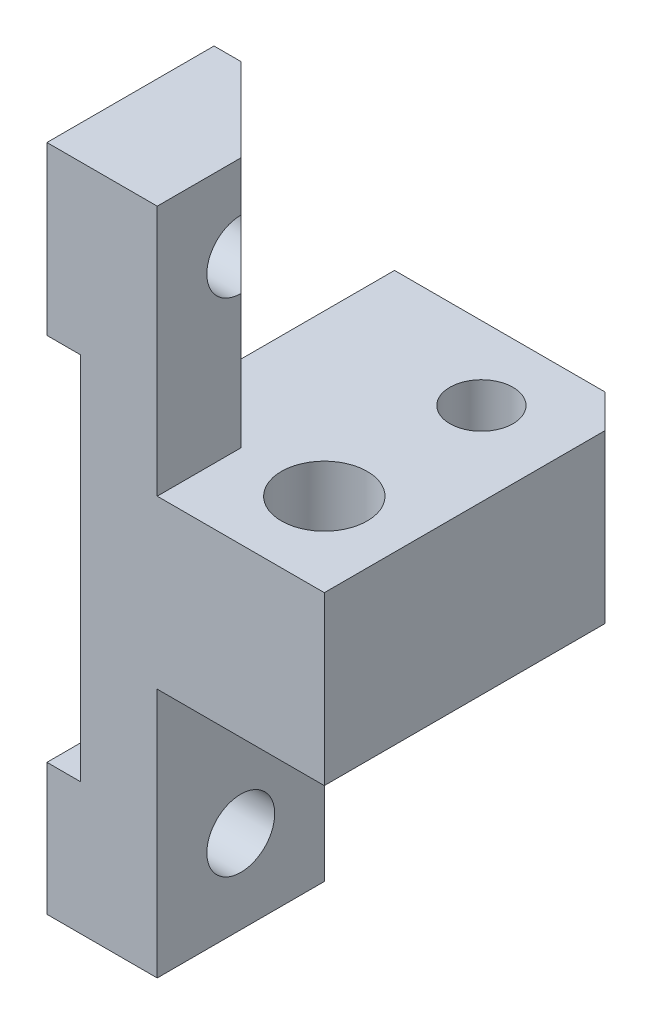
SolidWorks part; units mm, degrees
ref_plane "Front" through (0, 0, 0) normal (0, 0, 1) x (1, 0, 0)
ref_plane "Top" through (0, 0, 0) normal (0, 1, 0) x (1, 0, 0)
ref_plane "Right" through (0, 0, 0) normal (1, 0, 0) x (0, 0, -1)
sketch "Sketch1" plane through (0, 0, 0) normal (0, 0, 1) x (1, 0, 0)
  line L1 (0, 12.7) -> (4.191, 12.7)
  line L2 (0, 12.7) -> (0, -12.7)
  line L3 (0, -12.7) -> (4.191, -12.7)
  line L4 (4.191, 12.7) -> (4.191, -12.7)
  point P5 (0, 0)
  point P6 (0, 0)
  dimension "D1" = 4.191
  dimension "D2" = 25.4
extrude "Extrude1" add sketch "Sketch1" along normal blind 6.35
sketch "Sketch2" plane through (4.191, 0, 0) normal (1, 0, 0) x (0, 0, -1)
  line L0 (-6.35, -12.7) -> (-6.35, 12.7) construction
  line L1 (0, -3.1942) -> (-6.35, -3.1942)
  line L2 (0, -3.1942) -> (0, 3.1558)
  line L3 (0, 3.1558) -> (-6.35, 3.1558)
  line L4 (-6.35, -3.1942) -> (-6.35, 3.1558)
  line L8 (0, -12.7) -> (0, 12.7) construction
  dimension "D1" = 6.35
  dimension "D2" = 3.1558
extrude "Extrude2" add sketch "Sketch2" along normal blind 6.35
hole_wizard "#30 (0.128500) Diameter Hole1" positions "Sketch4" profile "Sketch3" hole size "#30" standard "Ansi Inch"
sketch "Sketch4" plane through (0, 3.1558, 0) normal (0, 1, 0) x (-1, 0, 0)
  line L1 (-10.541, 0) -> (-4.191, 0) construction
  line L2 (-4.191, 0) -> (-4.191, 6.35) construction
  point P0 (-7.366, 3.175)
  dimension "D1" = 3.175
  dimension "D2" = 3.175
sketch "Sketch3" plane through (7.366, 3.1558, 3.175) normal (1, 0, 0) x (0, 0, 1)
  line L0 (0, 0) -> (0, 15.8559)
  line L1 (0, 15.8559) -> (1.6319, 15.8559)
  line L2 (1.6319, 15.8559) -> (1.6319, 0)
  line L5 (1.6319, 0) -> (0, 0)
  line L11 (0, -6.35) -> (0, 107.95) construction
  dimension "Thru Hole Dia." = 3.2639
  dimension "Thru Hole Depth" = 15.8559
sketch "Sketch7" plane through (0, 0, 0) normal (0, 0, -1) x (-1, 0, 0)
  line L0 (-10.541, 3.1558) -> (-4.191, 3.1558) construction
  line L1 (-10.541, 3.1558) -> (0, 3.1558)
  line L2 (-10.541, 3.1558) -> (-10.541, -3.1942)
  line L3 (-10.541, -3.1942) -> (0, -3.1942)
  line L4 (0, 3.1558) -> (0, -3.1942)
  line L5 (0, 12.7) -> (0, -12.7) construction
  line L6 (-10.541, -3.1942) -> (-4.191, -3.1942) construction
  line L7 (-10.541, -3.1942) -> (-10.541, 3.1558) construction
extrude "Extrude3" add sketch "Sketch7" along normal blind 5.588
hole_wizard "3/32 (0.093750) Diameter Hole1" positions "Sketch6" profile "Sketch5" hole size "3/32" standard "Ansi Inch"
sketch "Sketch6" plane through (0, 3.1558, 0) normal (0, 1, 0) x (-1, 0, 0)
  line L2 (0, -5.588) -> (-10.541, -5.588) construction
  point P0 (-7.366, -2.794)
  dimension "D1" = 2.794
sketch "Sketch5" plane through (7.366, 3.1558, -2.794) normal (1, 0, 0) x (0, 0, 1)
  line L0 (0, 0) -> (0, 15.8559)
  line L1 (0, 15.8559) -> (1.2001, 15.8559)
  line L2 (1.2001, 15.8559) -> (1.2001, 0)
  line L5 (1.2001, 0) -> (0, 0)
  line L11 (0, -6.35) -> (0, 107.95) construction
  dimension "Thru Hole Dia." = 2.4003
  dimension "Thru Hole Depth" = 15.8559
chamfer "Chamfer1" distance 1.27 angle 45 1 edges at (10.541, -0.0192, -5.588)
chamfer "Chamfer2" distance 3.175 angle 45 1 edges
hole_wizard "#5-40 Tapped Hole1" positions "Sketch9" profile "Sketch8" tap size "#5-40" standard "Ansi Inch"
sketch "Sketch9" plane through (0, 0, 0) normal (-1, 0, 0) x (0, 0, 1)
  point P0 (3.175, -9.525)
  point P1 (3.175, 9.525)
  dimension "D1" = 9.525
  dimension "D2" = 19.05
  dimension "D3" = 3.175
  dimension "D4" = 3.175
sketch "Sketch8" plane through (0, -9.525, 3.175) normal (0, 1, 0) x (0, 0, 1)
  line L0 (0, 0) -> (0, 10.541)
  line L1 (0, 10.541) -> (1.289, 10.541)
  line L2 (1.289, 10.541) -> (1.289, 0)
  line L5 (1.289, 0) -> (0, 0)
  line L11 (0, -6.35) -> (0, 107.95) construction
  dimension "Thru Tap Drill Dia." = 2.5781
  dimension "Thru Tap Drill Depth" = 10.541
sketch "Sketch10" plane through (0, 0, 6.35) normal (1, 0, 0) x (0, 0, -1)
  line L1 (0, 12.7) -> (0, -12.7) construction
  line L2 (0, 6.35) -> (11.938, 6.35)
  line L3 (0, 6.35) -> (0, -7.6974)
  line L4 (0, -7.6974) -> (11.938, -7.6974)
  line L10 (11.938, 6.35) -> (11.938, -7.6974)
  line L11 (11.938, -3.1942) -> (11.938, 3.1558) construction
  line L12 (0, 12.7) -> (6.35, 12.7) construction
  point P8 (0, -0.6737)
  dimension "D1" = 6.35
extrude "Cut-Extrude1" cut sketch "Sketch10" along normal blind 1.27
